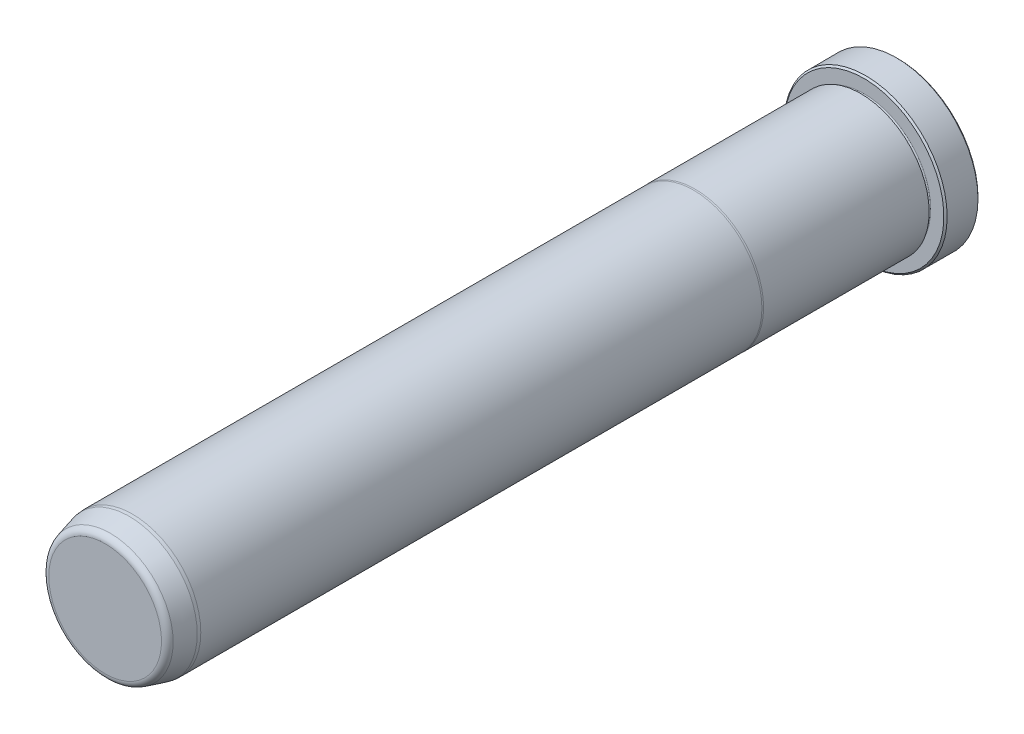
SolidWorks part; units mm, degrees
ref_plane "Front Plane" through (0, 0, 0) normal (0, 0, 1) x (1, 0, 0)
ref_plane "Top Plane" through (0, 0, 0) normal (0, 1, 0) x (1, 0, 0)
ref_plane "Right Plane" through (0, 0, 0) normal (1, 0, 0) x (0, 0, -1)
sketch "Sketch1" plane through (0, 0, 0) normal (1, 0, 0) x (0, 0, -1)
  line L0 (0, 0) -> (0, 18.923)
  line L1 (0, 18.923) -> (-7.9248, 18.923)
  line L2 (-7.9248, 18.923) -> (-7.9248, 15.4813)
  line L3 (-4.7498, 15.1003) -> (-5.5118, 15.1003) construction
  line L4 (-8.6868, 15.4813) -> (-8.6868, 15.8877)
  line L5 (-8.6868, 15.8877) -> (-47.1348, 15.8877)
  line L6 (-47.1348, 15.8877) -> (-47.498, 15.8623)
  line L7 (-47.498, 15.8623) -> (-177.8, 15.8623)
  line L9 (-184.15, 14.2983) -> (-184.15, 0)
  line L10 (-184.15, 0) -> (0, 0)
  line L11 (0, 0) -> (13.6287, 0) construction
  line L12 (-177.8, 15.8623) -> (-178.562, 15.7956)
  line L13 (-178.562, 15.7956) -> (-184.15, 14.2983)
  arc A0 (-8.6868, 15.4813) -> (-7.9248, 15.4813) centre (-8.3058, 15.4813) ccw
  dimension "D14" = 0.762
  dimension "D1" = 7.9248
  dimension "D2" = 0.762
  dimension "D3" = 37.846
  dimension "D4" = 31.7754
  dimension "D5" = 47.498
  dimension "D6" = 184.15
  dimension "D7" = 0.7874
  dimension "D8" = 4
  dimension "D9" = 31.7246
  dimension "D10" = 5
  dimension "D11" = 15
  dimension "D12" = 0.762
  dimension "D13" = 6.35
revolve "Revolve1" add sketch "Sketch1" angle 360 about L11
fillet "Fillet6" radius 1.5875 1 edges at (14.2983, 0, 184.15)
chamfer "Chamfer1" distance 0.381 angle 45 2 edges at (18.923, 0, 0) (18.923, 0, 7.9248)
